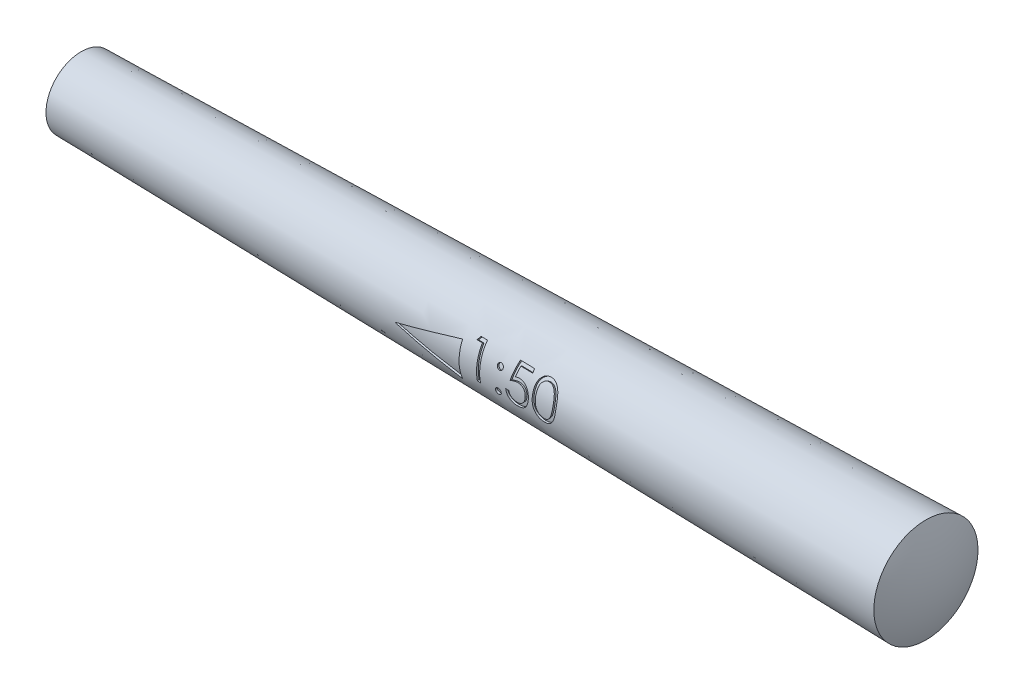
SolidWorks part; units mm, degrees
ref_plane "Front Plane" through (0, 0, 0) normal (0, 0, 1) x (1, 0, 0)
ref_plane "Top Plane" through (0, 0, 0) normal (0, 1, 0) x (1, 0, 0)
ref_plane "Right Plane" through (0, 0, 0) normal (1, 0, 0) x (0, 0, -1)
sketch "Sketch1" plane through (0, 0, 0) normal (1, 0, 0) x (0, 0, -1)
  circle A0 centre (0, 0) radius 1
  dimension "D1" = 2
extrude "Extrude1" add sketch "Sketch1" along normal mid plane 24
draft "Draft1" type of draft neutral plane draft angle 1.146 faces to draft 1 parameters "D1"=1.146
sketch "Sketch2" plane through (0, 0, 0) normal (0, 0, 1) x (1, 0, 0)
  line L0 (-12, 0) -> (-12, 1)
  line L1 (-12, 1) -> (-12, -1) construction
  line L2 (-12, 0) -> (-12.3, 0)
  line L3 (-12.3, 0) -> (-12.3, -1.24) construction
  line L4 (12, 0) -> (12, 1.48)
  line L5 (12, -1.48) -> (12, 1.48) construction
  line L6 (12, 0) -> (12.3, 0)
  line L7 (12.3, 0) -> (12.3, -1.24) construction
  line L8 (-12, -1) -> (12, -1.48) construction
  arc A0 (-12.3, 0) -> (-12, 1) centre (-10.4833, 0) cw
  arc A1 (12.3, 0) -> (12, 1.48) centre (8.4993, 0) ccw
  point P14 (0, -1.24)
revolve "Revolve1" add sketch "Sketch2" angle 360 about L2
sketch "Sketch5" plane through (0, 0, 0) normal (0, 0, 1) x (1, 0, 0)
  line L0 (0, 1.24) -> (0, -1.24) construction
  line L1 (12, 1.48) -> (-12, 1) construction
  line L2 (-12, -1) -> (12, -1.48) construction
ref_plane "Plane2" through (0, 0, 0) normal (-0.02, 0, 0.9998) x (0.9998, 0, 0.02)
sketch "Sketch6" plane through (0, 0, 0) normal (-0.02, 0, 0.9998) x (0.9998, 0, 0.02)
  line L0 (0, 0) -> (0, 0.5)
  line L1 (0, 1.24) -> (0, -1.24) construction
  line L2 (0, 0.5) -> (-1.866, 0)
  line L3 (-1.866, 0) -> (0, -0.5)
  line L4 (0, -0.5) -> (0, 0)
  line L5 (0, -0.25) -> (3, -0.25) construction
  text T0 "1:50" font "Century Gothic" height 1
  dimension "D1" = 1
  dimension "D2" = 30
  dimension "D3" = 3
wrap "Wrap2" sketch "Sketch6" wrap type deboss source sketch "Sketch6" thickness 0.05 parameters "D1"=0.05
equation "\"D2@Sketch2\" = \"D1@Sketch2\""
